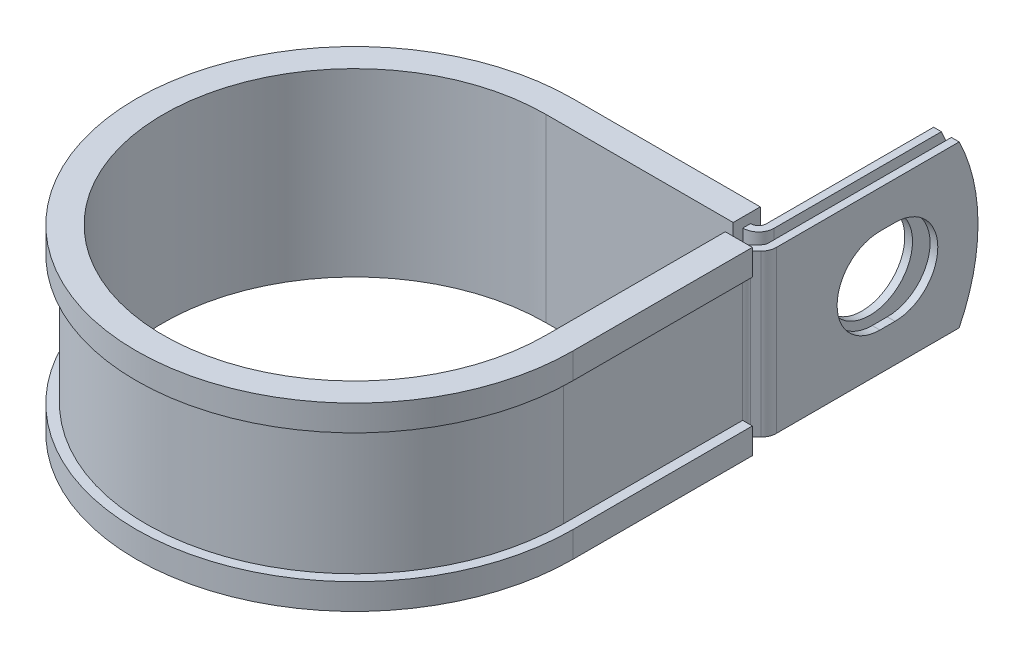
SolidWorks part; units mm, degrees
ref_plane "Front Plane" through (0, 0, 0) normal (0, 0, 1) x (1, 0, 0)
ref_plane "Top Plane" through (0, 0, 0) normal (0, 1, 0) x (1, 0, 0)
ref_plane "Right Plane" through (0, 0, 0) normal (1, 0, 0) x (0, 0, -1)
sketch "Sketch1" plane through (0, 0, 0) normal (0, 1, 0) x (1, 0, 0)
  line L0 (0, 31.6865) -> (29.5708, 31.6865)
  line L1 (31.6865, 0) -> (31.6865, 28.274)
  line L2 (32.0092, 63.4746) -> (32.0092, 34.1249)
  line L3 (32.4007, 29.9982) -> (33.2269, 30.8244)
  line L5 (33.584, 31.6865) -> (33.584, 63.4746)
  arc A0 (0, 31.6865) -> (31.6865, 0) centre (0, 0) ccw
  arc A1 (32.4007, 29.9982) -> (31.6865, 28.274) centre (34.1249, 28.274) ccw
  arc A2 (33.2269, 30.8244) -> (33.584, 31.6865) centre (32.3648, 31.6865) ccw
  arc A3 (29.5708, 31.6865) -> (32.0092, 34.1249) centre (29.5708, 34.1249) ccw
extrude "Extrude-Thin1" add sketch "Sketch1" along normal mid plane 25.4 thin
sketch "Sketch2" plane through (30.79, 0, 0) normal (-1, 0, 0) x (0, 0, 1)
  line L0 (-63.4746, 12.7) -> (-63.4746, -12.7) construction
  line L1 (0, 12.7) -> (0, -12.7) construction
  circle A0 centre (-49.1998, 0) radius 6.7437
  point P2 (-63.4746, 0)
extrude "Cut-Extrude1" cut sketch "Sketch2" against normal up to surface (1.2192 mm away)
sketch "Sketch3" plane through (34.8032, 0, 0) normal (1, 0, 0) x (0, 0, -1)
  line L0 (48.006, 0) -> (50.3936, 0) construction
  line L1 (48.006, 6.7437) -> (50.3936, 6.7437)
  line L2 (48.006, -6.7437) -> (50.3936, -6.7437)
  line L3 (63.4746, 12.7) -> (63.4746, -12.7) construction
  arc A0 (48.006, 6.7437) -> (48.006, -6.7437) centre (48.006, 0) ccw
  arc A1 (50.3936, -6.7437) -> (50.3936, 6.7437) centre (50.3936, 0) ccw
  point P3 (49.1998, 0)
  point P8 (63.4746, 0)
  point P11 (41.2623, 0)
  point P12 (57.1373, 0)
extrude "Cut-Extrude2" cut sketch "Sketch3" against normal up to surface (1.2192 mm away)
sketch "Sketch4" plane through (30.79, 0, 0) normal (-1, 0, 0) x (0, 0, 1)
  line L0 (-63.4746, 12.7) -> (-63.4746, -12.7)
  line L1 (-63.4746, 12.7) -> (-60.4973, 12.7)
  line L2 (-63.4746, 12.7) -> (-34.1249, 12.7) construction
  line L3 (-63.4746, -12.7) -> (-60.4973, -12.7)
  line L4 (-63.4746, -12.7) -> (-34.1249, -12.7) construction
  arc A0 (-60.4973, 12.7) -> (-60.4973, -12.7) centre (-34.8996, 0) ccw
extrude "Cut-Extrude3" cut sketch "Sketch4" against normal through all contours A0 M4 M5 | A0 L0 M2
ref_plane "Plane1" through (0, 0, -28.274) normal (0, 0, -1) x (-1, 0, 0)
ref_plane "Plane2" through (29.52, 0, 0) normal (-1, 0, 0) x (0, 0, 1)
sketch "Sketch5" plane through (0, 0, -28.274) normal (0, 0, -1) x (-1, 0, 0)
  line L0 (-32.9057, 12.7) -> (-31.6865, 12.7)
  line L1 (-32.9057, 12.7) -> (-32.9057, -12.7) construction
  line L3 (-31.6865, 12.7) -> (-31.6865, -12.7)
  line L4 (-31.6865, -12.7) -> (-32.9057, -12.7)
  line L5 (-32.9057, -12.7) -> (-32.9057, -10.16)
  line L6 (-32.9057, 12.7) -> (-32.9057, 10.16)
  line L7 (-34.4297, 14.224) -> (-34.4297, 10.16)
  line L8 (-34.4297, 14.224) -> (-30.1625, 14.224)
  line L9 (-30.1625, 14.224) -> (-30.1625, -14.224)
  line L10 (-30.1625, -14.224) -> (-34.4297, -14.224)
  line L11 (-34.4297, -14.224) -> (-34.4297, -10.16)
  line L12 (-34.4297, 10.16) -> (-32.9057, 10.16)
  line L13 (-32.9057, -10.16) -> (-34.4297, -10.16)
sketch "Sketch6" plane through (0, 12.7, 0) normal (0, 1, 0) x (1, 0, 0)
  line L0 (30.1625, 0) -> (30.1625, 28.274)
  line L1 (30.1625, 28.274) -> (34.4297, 28.274) construction
  line L2 (29.52, 6.9878) -> (29.52, -6.9878) construction
  line L5 (0, 30.1625) -> (29.52, 30.1625)
  arc A0 (0, 30.1625) -> (30.1625, 0) centre (0, 0) ccw
sweep "Sweep1" add profiles "Sketch5" path "Sketch6"
equation "\"D4@Sketch5\" = \"D1@Extrude-Thin1\""
equation "\"D5@Sketch5\" = \"D5@Extrude-Thin1\""
equation "\"D1@Sketch3\" = \"D2@Sketch2\""
equation "\"D7@Sketch1\" = \"D3@Sketch2\" + \"D1@Sketch3\""
equation "\"D1@Sketch1\" = \"D1@Sketch6\" + 2 * \"D3@Sketch5\""
equation "\"D1@Sketch4\" = ( \"D1@Extrude-Thin1\" + .125 ) * 2"
equation "\"D9@Sketch1\"= \"D5@Extrude-Thin1\""
equation "\"D8@Sketch1\"= 2 * \"D5@Extrude-Thin1\""
equation "\"D2@Sketch1\" = 2 * \"D5@Extrude-Thin1\""
equation "\"D2@Sketch3\" = \"D1@Sketch2\""
